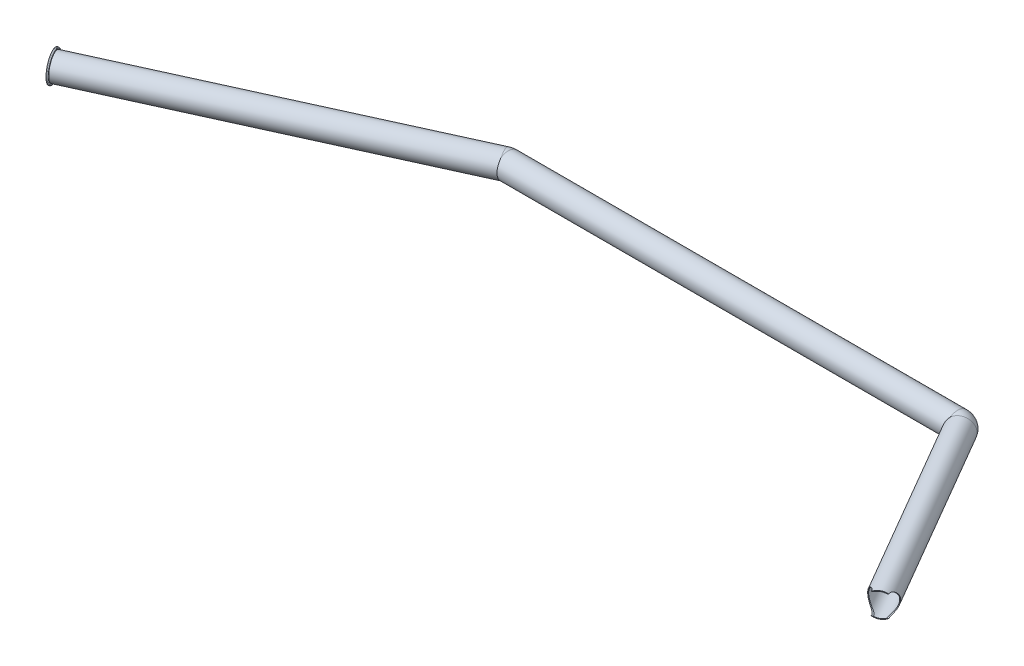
SolidWorks part; units mm, degrees
ref_plane "Plan de face" through (0, 0, 0) normal (0, 0, 1) x (1, 0, 0)
ref_plane "Plan de dessus" through (0, 0, 0) normal (0, 1, 0) x (1, 0, 0)
ref_plane "Plan de droite" through (0, 0, 0) normal (1, 0, 0) x (0, 0, -1)
sketch "Esquisse4" plane through (0, 0, 0) normal (0, 1, 0) x (1, 0, 0)
  line L0 (0, 0) -> (438.0281, 199.1037)
  line L1 (442.1661, 200) -> (1075.9789, 200)
  line L2 (1084.6224, 195.0289) -> (1241.7301, -75)
  arc A0 (442.1661, 200) -> (438.0281, 199.1037) centre (442.1661, 190) ccw
  arc A1 (1084.6224, 195.0289) -> (1075.9789, 200) centre (1075.9789, 190) ccw
  point P8 (440, 200)
  point P11 (1081.7301, 200)
  dimension "D5" = 10
  dimension "D1" = 200
  dimension "D2" = 157.1077
  dimension "D3" = 270.0289
  dimension "D4" = 438.0281
ref_plane "Plan2" through (0, 0, 0) normal (0.9104, 0, -0.4138) x (-0.4138, 0, -0.9104)
sketch "Esquisse5" plane through (0, 0, 0) normal (0.9104, 0, -0.4138) x (-0.4138, 0, -0.9104)
  circle A0 centre (0, 0) radius 17.5
  circle A1 centre (0, 0) radius 16.5
  dimension "D1" = 35
  dimension "D2" = 33
sweep "Balayage1" add profiles "Esquisse5" path "Esquisse4"
ref_plane "Plan3" through (910.3665, 0, -413.8029) normal (0.9104, 0, -0.4138) x (-0.4138, 0, -0.9104)
sketch "Esquisse8" plane through (910.3665, 0, -413.8029) normal (0.9104, 0, -0.4138) x (-0.4138, 0, -0.9104)
  circle A0 centre (-581.2721, 0) radius 15
  dimension "D1" = 310
  dimension "D2" = 30
extrude "Enlèv. mat.-Extru.2" cut sketch "Esquisse8" along normal through all
sketch "Esquisse10" plane through (0, 0, 0) normal (0.9104, 0, -0.4138) x (-0.4138, 0, -0.9104)
  circle A0 centre (0, 0) radius 20
  dimension "D1" = 40
extrude "Extrusion1" add sketch "Esquisse10" along normal blind 2
fillet "Congé5" radius 1.5 1 edges at (-6.4553, 0, -19.0349)
sketch "Esquisse11" plane through (0, 0, 0) normal (0.9104, 0, -0.4138) x (-0.4138, 0, -0.9104)
  circle A0 centre (0, 0) radius 4
  dimension "D1" = 8
extrude "Enlèv. mat.-Extru.5" cut sketch "Esquisse11" along normal blind 5
